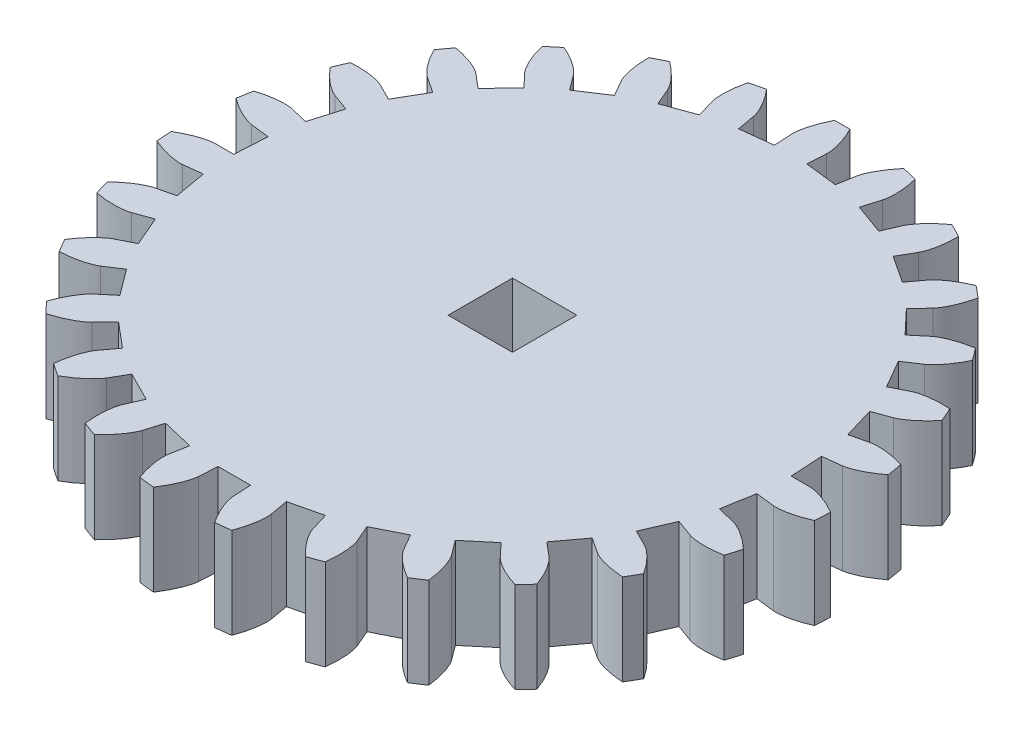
SolidWorks part; units mm, degrees
ref_plane "Front Plane" through (0, 0, 0) normal (0, 0, 1) x (1, 0, 0)
ref_plane "Top Plane" through (0, 0, 0) normal (0, 1, 0) x (1, 0, 0)
ref_plane "Right Plane" through (0, 0, 0) normal (1, 0, 0) x (0, 0, -1)
sketch "Sketch1" plane through (0, 0, 0) normal (0, 1, 0) x (1, 0, 0)
  line L0 (0, 0) -> (0, 3.2675) construction
  line L1 (0, 0) -> (-3.2675, 0) construction
  line L2 (0, 0) -> (-3.6189, -0.2108) construction
  line L3 (0, 0) -> (-3.2454, -0.3793) construction
  line L4 (0, 0) -> (-3.1794, -0.7535) construction
  circle A0 centre (0, 0) radius 3.375 construction
  circle A1 centre (0, 0) radius 3.2675 construction
  circle A2 centre (0, 0) radius 3.0625 construction
  circle A3 centre (0, 0) radius 3.625 construction
  spline S0 degree 4 poles (-3.2675, 0) (-3.2719, 0) (-3.2843, -0.0005) (-3.3076, -0.0031) (-3.3453, -0.01) (-3.3926, -0.0224) (-3.4526, -0.0425) (-3.5215, -0.0715) (-3.595, -0.1087) (-3.6722, -0.1547) (-3.7464, -0.2054) (-3.8178, -0.2602) (-3.8861, -0.3186) (-3.9656, -0.3935) (-4.0559, -0.489) (-4.1538, -0.6085) (-4.2553, -0.7525) (-4.3479, -0.9076) (-4.4297, -1.0666) (-4.5013, -1.2336) (-4.5625, -1.3996) (-4.6142, -1.577) (-4.6558, -1.7435) (-4.6888, -1.9343) (-4.7114, -2.0896) (-4.7266, -2.2977) (-4.7311, -2.4215) (-4.7313, -2.5671) (-4.7287, -2.6321) (-4.7271, -2.6721) knots 0 0 0 0 0 0.005377 0.015084 0.028532 0.04661 0.064855 0.092111 0.119476 0.146842 0.174209 0.201575 0.228941 0.256307 0.307035 0.361767 0.4165 0.471232 0.525964 0.580697 0.635429 0.690161 0.744894 0.799626 0.854358 0.909091 0.954545 1 1 1 1 1 construction
  spline S1 degree 4 poles (-3.2675, 0) (-3.2719, 0) (-3.2843, -0.0005) (-3.3076, -0.0031) (-3.3453, -0.01) (-3.3926, -0.0224) (-3.4526, -0.0425) (-3.5215, -0.0715) (-3.595, -0.1087) (-3.6722, -0.1547) (-3.7464, -0.2054) (-3.8178, -0.2602) (-3.8861, -0.3186) (-3.9656, -0.3935) (-4.0559, -0.489) (-4.1538, -0.6085) (-4.2553, -0.7525) (-4.3479, -0.9076) (-4.4297, -1.0666) (-4.5013, -1.2336) (-4.5625, -1.3996) (-4.6142, -1.577) (-4.6558, -1.7435) (-4.6888, -1.9343) (-4.7114, -2.0896) (-4.7233, -2.2526) (-4.7274, -2.3323) (-4.7287, -2.3731) knots 0 0 0 0 0 0.005377 0.015084 0.028532 0.04661 0.064855 0.092111 0.119476 0.146842 0.174209 0.201575 0.228941 0.256307 0.307035 0.361767 0.4165 0.471232 0.525964 0.580697 0.635429 0.690161 0.744894 0.799626 0.854358 0.909091 0.909091 0.909091 0.909091 0.909091
  dimension "D1" = 7.25
  dimension "D2" = 6.75
  dimension "D3" = 6.535
  dimension "D4" = 6.125
  dimension "D5" = 3.2675
  dimension "D6" = 3.333
  dimension "D7" = 6.667
  dimension "D8" = 13.333
sketch "Sketch2" plane through (0, 0, 0) normal (0, 1, 0) x (1, 0, 0)
  line L0 (0, 0) -> (-3.6189, -0.2108) construction
  line L1 (0, 0) -> (-3.6189, -0.2108) construction
  line L2 (0, 0) -> (-3.2454, -0.3793) construction
  line L3 (0, 0) -> (-3.2675, 0) construction
  line L4 (0, 0) -> (-3.1794, -0.7535) construction
  line L5 (0, 0) -> (-3.2454, -0.3793) construction
  line L6 (0, 0) -> (-3.2675, 0) construction
  line L7 (0, 0) -> (-3.1794, -0.7535) construction
  line L8 (-3.2454, -0.3793) -> (-3.0418, -0.3555)
  line L9 (-3.0418, -0.3555) -> (-2.9799, -0.7063)
  line L10 (-2.9799, -0.7063) -> (-3.1794, -0.7535) construction
  line L11 (-2.9799, -0.7063) -> (-0.4865, -0.1153)
  line L12 (-3.2675, 0) -> (-0.5, 0)
  circle A0 centre (0, 0) radius 3.0625 construction
  circle A1 centre (0, 0) radius 3.2675 construction
  circle A2 centre (0, 0) radius 3.375 construction
  circle A3 centre (0, 0) radius 3.625 construction
  circle A4 centre (0, 0) radius 3.0625 construction
  circle A5 centre (0, 0) radius 3.2675 construction
  circle A6 centre (0, 0) radius 3.375 construction
  circle A7 centre (0, 0) radius 3.625 construction
  arc A8 (-3.6129, -0.2955) -> (-3.6228, -0.126) centre (0, 0) cw
  circle A11 centre (0, 0) radius 0.5 construction
  arc A12 (-0.5, 0) -> (-0.4865, -0.1153) centre (0, 0) ccw
  spline S0 degree 4 poles (-35.0993, -999.4915) (-2.47, -16.2177) (-2.4862, -0.3012) (-2.9436, 0.0631) (-3.3453, -0.01) (-3.3926, -0.0224) (-3.4526, -0.0425) (-3.5215, -0.0715) (-3.595, -0.1087) (-3.6722, -0.1547) (-3.7464, -0.2054) (-3.8178, -0.2602) (-3.8861, -0.3186) (-3.9656, -0.3935) (-4.0559, -0.489) (-4.1538, -0.6085) (-4.2553, -0.7525) (-4.3479, -0.9076) (-4.4297, -1.0666) (-4.5013, -1.2336) (-4.5625, -1.3996) (-4.6142, -1.577) (-4.6558, -1.7435) (-4.6888, -1.9343) (-4.8001, -2.6975) (-4.7076, -5.2209) (-3.3656, 24.9574) (-37.0828, -1001.8432) knots -0.45029 -0.45029 -0.45029 -0.45029 -0.45029 0.005377 0.015084 0.028532 0.04661 0.064855 0.092111 0.119476 0.146842 0.174209 0.201575 0.228941 0.256307 0.307035 0.361767 0.4165 0.471232 0.525964 0.580697 0.635429 0.690161 0.744894 0.799626 0.854358 1.765945 1.765945 1.765945 1.765945 1.765945 only from (-3.2675, 0) to (-4.7287, -2.3731) construction
  spline S1 degree 4 poles (-3.2675, 0) (-3.2719, 0) (-3.2843, -0.0005) (-3.3076, -0.0031) (-3.3453, -0.01) (-3.3926, -0.0224) (-3.4526, -0.0425) (-3.5187, -0.0703) (-3.5695, -0.0958) (-3.606, -0.1162) (-3.6228, -0.126) knots 0 0 0 0 0 0.005377 0.015084 0.028532 0.04661 0.064855 0.092111 0.115778 0.115778 0.115778 0.115778 0.115778
  spline S2 degree 4 poles (-3.2454, -0.3793) (-3.2498, -0.3798) (-3.2621, -0.3808) (-3.2856, -0.3809) (-3.3238, -0.3785) (-3.3722, -0.3716) (-3.4342, -0.3586) (-3.503, -0.3386) (-3.5565, -0.3192) (-3.5951, -0.3032) (-3.6129, -0.2955) knots 0 0 0 0 0 0.005377 0.015084 0.028532 0.04661 0.064855 0.092111 0.115778 0.115778 0.115778 0.115778 0.115778
  point P21 (-3.0418, -0.3555)
  point P24 (-2.9799, -0.7063)
  dimension "D2" = 1
extrude "Boss-Extrude1" add sketch "Sketch2" along normal blind 1
pattern_circular "CirPattern1" count 27 over 360 of "Boss-Extrude1"
sketch "Sketch3" plane through (0, 1, 0) normal (0, 1, 0) x (1, 0, 0)
  line L1 (-0.3536, -0.3536) -> (0.3536, -0.3536)
  line L2 (-0.3536, -0.3536) -> (-0.3536, 0.3536)
  line L3 (-0.3536, 0.3536) -> (0.3536, 0.3536)
  line L4 (0.3536, -0.3536) -> (0.3536, 0.3536)
  line L5 (-0.3536, -0.3536) -> (0.3536, 0.3536) construction
  line L6 (-0.3536, 0.3536) -> (0.3536, -0.3536) construction
  circle A0 centre (0, 0) radius 0.5 construction
  circle A1 centre (0, 0) radius 0.5
  point P0 (0, 0)
extrude "Boss-Extrude2" add sketch "Sketch3" against normal blind 1 contours L2 A1 | L3 A1 | L4 A1 | L1 A1
equation "\"Module\"= .25"
equation "\"Number of Teeth\" = 27"
equation "\"Pressure Angle\"= 14.5deg"
equation "\"Pitch Diameter\"= \"Number of Teeth\" * \"Module\""
equation "\"Circular Pitch\"= pi * \"Module\""
equation "\"Addendum\"= \"Module\""
equation "\"Dedendum\"= 1.25 * \"Module\""
equation "\"Base Diameter\"= \"Pitch Diameter\" * cos ( \"Pressure Angle\" )"
equation "\"Base Radius\"= \"Base Diameter\" / 2"
equation "\"Width\"= 1"
equation "\"Outside Diameter\"= \"Pitch Diameter\" + 2 * \"Addendum\""
equation "\"D1@Sketch1\"=\"Outside Diameter\""
equation "\"D3@Sketch1\"=\"Base Diameter\""
equation "\"Root Diameter\"= \"Pitch Diameter\" - 2 * \"Dedendum\""
equation "\"D4@Sketch1\"=\"Root Diameter\""
equation "\"Tooth Angle\"= 360 / \"Number of Teeth\""
equation "\"D6@Sketch1\"=\"Tooth Angle\"/4"
equation "\"D7@Sketch1\"=\"Tooth Angle\"/2"
equation "\"D8@Sketch1\"=\"Tooth Angle\""
equation "\"D2@Sketch1\" = \"Pitch Diameter\""
equation "\"Shaft Diameter\"= 1"
equation "\"D1@CirPattern1\" = \"Number of Teeth\""
equation "\"D2@Sketch2\"= \"Shaft Diameter\""
equation "\"D1@Boss-Extrude1\" = \"Width\""
